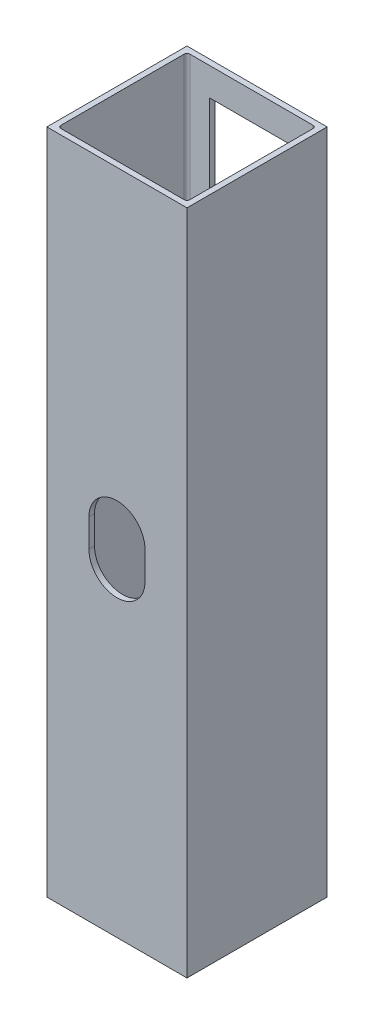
SolidWorks part; units mm, degrees
ref_plane "Front Plane" through (0, 0, 0) normal (0, 0, 1) x (1, 0, 0)
ref_plane "Top Plane" through (0, 0, 0) normal (0, 1, 0) x (1, 0, 0)
ref_plane "Right Plane" through (0, 0, 0) normal (1, 0, 0) x (0, 0, -1)
sketch "Sketch2" plane through (0, 0, 0) normal (0, 1, 0) x (1, 0, 0)
  line L1 (0, 0) -> (63.5, 0)
  line L2 (0, 0) -> (0, 63.5)
  line L3 (0, 63.5) -> (63.5, 63.5)
  line L4 (63.5, 0) -> (63.5, 63.5)
extrude "Boss-Extrude2" add sketch "Sketch2" against normal blind 304.8
sketch "Sketch3" plane through (0, 0, 0) normal (0, 1, 0) x (1, 0, 0)
  line L0 (0, 0) -> (0, 2.54)
  line L1 (0, 63.5) -> (0, 0) construction
  line L2 (0, 2.54) -> (2.54, 2.54)
  line L3 (63.5, 63.5) -> (63.5, 60.96)
  line L4 (63.5, 60.96) -> (60.96, 60.96)
  line L6 (2.54, 2.54) -> (60.96, 2.54)
  line L7 (2.54, 2.54) -> (2.54, 60.96)
  line L8 (2.54, 60.96) -> (60.96, 60.96)
  line L9 (60.96, 2.54) -> (60.96, 60.96)
extrude "Cut-Extrude2" cut sketch "Sketch3" against normal blind 302.26 contours L6 L9 L8 L7
sketch3d "3DSketch1"
  line L0 (0, 0, -63.5) -> (0, 0, 0) construction
  point P0 (0, 0, -61.7439)
sketch "Sketch5" plane through (0, 0, 0) normal (0, 1, 0) x (1, 0, 0)
  line L1 (0, 0) -> (63.5, 0)
  line L2 (0, 0) -> (0, 63.5)
  line L3 (0, 63.5) -> (63.5, 63.5)
  line L4 (63.5, 0) -> (63.5, 63.5)
extrude "Cut-Extrude3" cut sketch "Sketch5" against normal blind 2.54
sketch "Sketch6" plane through (0, 0, 0) normal (0, 0, 1) x (1, 0, 0)
  line L0 (0, -304.8) -> (63.5, -304.8)
  line L1 (63.5, -304.8) -> (31.75, -304.8)
  line L2 (31.75, -304.8) -> (31.75, -152.4)
  circle A0 centre (31.75, -152.4) radius 12.7
extrude "Cut-Extrude4" cut sketch "Sketch6" against normal blind 12.7
sketch "Sketch11" plane through (0, 0, 0) normal (0, 0, 1) x (1, 0, 0)
  line L0 (31.75, -152.4) -> (31.75, -158.75)
  line L1 (44.45, -152.4) -> (44.45, -173.6752)
  line L2 (19.05, -152.4) -> (19.05, -158.75)
  circle A0 centre (31.75, -152.4) radius 12.7 construction
  circle A1 centre (31.75, -158.75) radius 12.7
extrude "Cut-Extrude7" cut sketch "Sketch11" against normal blind 2.54 contours A1 L2 M3 | A1 M3 | A1 L1 M3
sketch "Sketch12" plane through (0, 0, 0) normal (0, 0, 1) x (1, 0, 0)
  line L0 (31.75, -152.4) -> (31.75, -146.05)
  line L1 (19.05, -146.05) -> (19.05, -155.575)
  line L2 (19.05, -152.4) -> (19.05, -158.75) construction
  line L3 (44.45, -146.05) -> (44.45, -158.75)
  circle A0 centre (31.75, -146.05) radius 12.7
extrude "Cut-Extrude8" cut sketch "Sketch12" against normal blind 2.54 contours A0 M3 | A0 L1 M3 | A0 L3 M3
sketch "Sketch14" plane through (0, 0, -63.5) normal (0, 0, -1) x (-1, 0, 0)
  line L0 (-63.5, -304.8) -> (-50.8, -304.8)
  line L1 (-63.5, -304.8) -> (0, -304.8) construction
  line L2 (-50.8, -304.8) -> (-50.8, -292.1)
  line L3 (0, -2.54) -> (0, -15.24)
  line L4 (0, -304.8) -> (0, -2.54) construction
  line L5 (0, -15.24) -> (-12.7, -15.24)
  line L7 (-12.7, -15.24) -> (-50.8, -15.24)
  line L8 (-12.7, -15.24) -> (-12.7, -292.1)
  line L9 (-12.7, -292.1) -> (-50.8, -292.1)
  line L10 (-50.8, -15.24) -> (-50.8, -292.1)
extrude "Cut-Extrude9" cut sketch "Sketch14" against normal blind 2.54 contours L7 L10 L9 L8
fillet "Fillet1" radius 1.27 4 edges at (2.54, -152.4, -2.54) (2.54, -152.4, -60.96) (60.96, -152.4, -60.96) (60.96, -152.4, -2.54)
